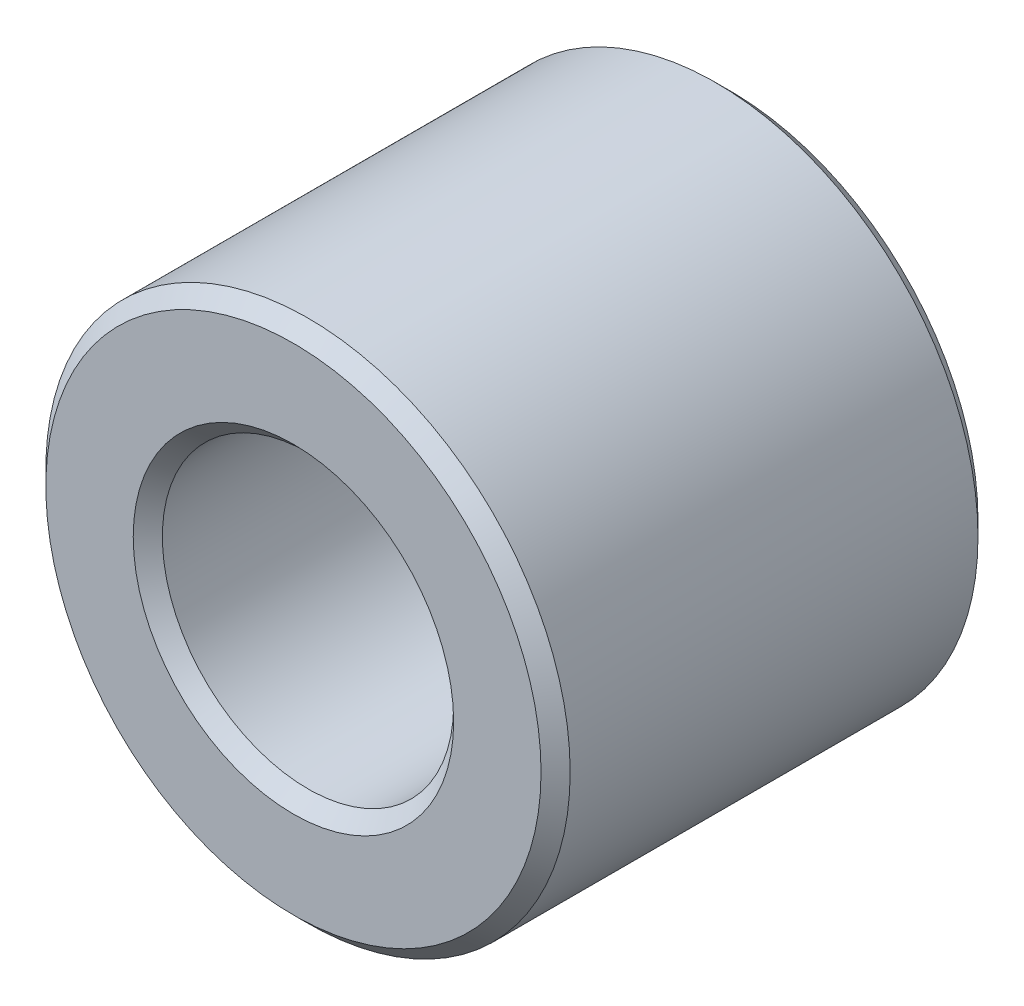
SolidWorks part; units mm, degrees
ref_plane "Front Plane" through (0, 0, 0) normal (0, 0, 1) x (1, 0, 0)
ref_plane "Top Plane" through (0, 0, 0) normal (0, 1, 0) x (1, 0, 0)
ref_plane "Right Plane" through (0, 0, 0) normal (1, 0, 0) x (0, 0, -1)
sketch "Sketch1" plane through (0, 0, 0) normal (0, 0, 1) x (1, 0, 0)
  circle A0 centre (0, 0) radius 25
  circle A1 centre (0, 0) radius 45
  dimension "D1" = 50
  dimension "D2" = 90
extrude "Boss-Extrude1" add sketch "Sketch1" along normal mid plane 75
chamfer "Chamfer1" distance 2.5 angle 45 4 edges at (25, 0, -37.5) (45, 0, -37.5) (25, 0, 37.5) (45, 0, 37.5)
